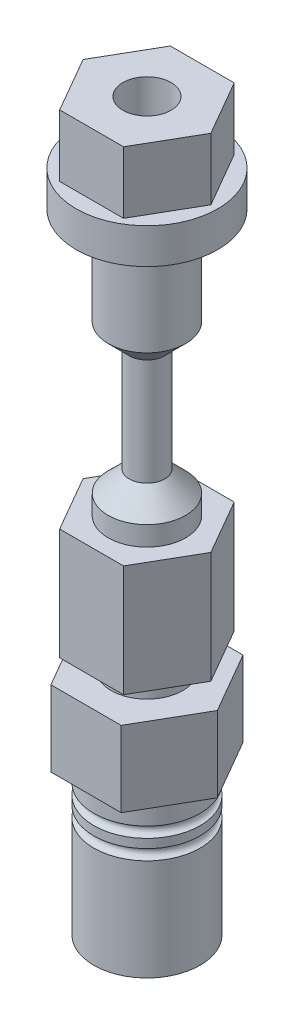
SolidWorks part; units mm, degrees
ref_plane "Front Plane" through (0, 0, 0) normal (0, 0, 1) x (1, 0, 0)
ref_plane "Top Plane" through (0, 0, 0) normal (0, 1, 0) x (1, 0, 0)
ref_plane "Right Plane" through (0, 0, 0) normal (1, 0, 0) x (0, 0, -1)
sketch "Sketch2" plane through (0, 0, 0) normal (0, 1, 0) x (1, 0, 0)
  line L1 (4.5827, 7.9375) -> (-4.5827, 7.9375)
  line L2 (-4.5827, 7.9375) -> (-9.1654, 0)
  line L3 (-9.1654, 0) -> (-4.5827, -7.9375)
  line L4 (-4.5827, -7.9375) -> (4.5827, -7.9375)
  line L5 (4.5827, -7.9375) -> (9.1654, 0)
  line L6 (9.1654, 0) -> (4.5827, 7.9375)
  circle A1 centre (0, 0) radius 7.9375 construction
  dimension "D1" = 15.875
extrude "Boss-Extrude1" add sketch "Sketch2" along normal blind 8.89
sketch "Sketch3" plane through (0, 0, 0) normal (0, 0, 1) x (1, 0, 0)
  line L0 (0, 0) -> (0, -52.7983) construction
  line L1 (-2.54, -22.0662) -> (-2.54, -37.3698)
  line L3 (-2.54, -37.3698) -> (-5.5562, -40.386)
  line L5 (0, -53.086) -> (0, 0)
  line L7 (-5.5562, -40.386) -> (-5.5562, -53.086)
  line L8 (-5.5562, -53.086) -> (0, -53.086)
  line L9 (0, 0) -> (-10.16, 0)
  line L11 (-10.16, 0) -> (-10.16, -5.08)
  line L12 (-10.16, -5.08) -> (-4.6266, -5.08)
  line L13 (-4.6266, -5.08) -> (-4.6266, -7.1628)
  line L16 (-4.6266, -7.1628) -> (-5.5562, -7.1628)
  line L17 (-5.5562, -7.1628) -> (-5.5562, -19.05)
  line L18 (-5.5562, -19.05) -> (-2.54, -22.0662)
  line L19 (-4.5827, 8.89) -> (4.5827, 8.89) construction
  dimension "D1" = 5.08
  dimension "D2" = 135
  dimension "D3" = 11.1125
  dimension "D4" = 61.976
  dimension "D5" = 12.7
  dimension "D7" = 20.32
  dimension "D8" = 5.08
  dimension "D9" = 9.2532
  dimension "D10" = 2.0828
  dimension "D11" = 11.1125
  dimension "D12" = 11.8872
  dimension "D13" = 45
revolve "Revolve1" add sketch "Sketch3" angle 360 about L0
ref_plane "Plane1" through (0, -43.18, 0) normal (0, 1, 0) x (1, 0, 0)
sketch "Sketch5" plane through (0, -43.18, 0) normal (0, -1, 0) x (1, 0, 0)
  line L1 (4.5827, 7.9375) -> (-4.5827, 7.9375)
  line L2 (-4.5827, 7.9375) -> (-9.1654, 0)
  line L3 (-9.1654, 0) -> (-4.5827, -7.9375)
  line L4 (-4.5827, -7.9375) -> (4.5827, -7.9375)
  line L5 (4.5827, -7.9375) -> (9.1654, 0)
  line L6 (9.1654, 0) -> (4.5827, 7.9375)
  circle A0 centre (0, 0) radius 7.9375 construction
  dimension "D1" = 15.875
extrude "Boss-Extrude3" add sketch "Sketch5" along normal blind 16.002
sketch "Sketch7" plane through (0, 0, 0) normal (0, 0, 1) x (1, 0, 0)
  line L0 (0, -59.182) -> (0, -64.0951) construction
  line L1 (4.5827, -59.182) -> (-4.5827, -59.182) construction
  line L2 (-4.8095, -51.6301) -> (-5.1435, -62.357)
  line L3 (-5.1435, -62.357) -> (0, -62.357)
  line L4 (0, -62.357) -> (0, -51.6301)
  line L5 (0, -51.6301) -> (-4.8095, -51.6301)
  dimension "D1" = 1.783
  dimension "D2" = 10.287
  dimension "D3" = 3.175
revolve "Revolve2" add sketch "Sketch7" angle 360 about L0
sketch "Sketch8" plane through (0, -62.357, 0) normal (0, -1, 0) x (1, 0, 0)
  line L1 (5.0447, 8.7376) -> (-5.0447, 8.7376)
  line L2 (-5.0447, 8.7376) -> (-10.0893, 0)
  line L3 (-10.0893, 0) -> (-5.0447, -8.7376)
  line L4 (-5.0447, -8.7376) -> (5.0447, -8.7376)
  line L5 (5.0447, -8.7376) -> (10.0893, 0)
  line L6 (10.0893, 0) -> (5.0447, 8.7376)
  circle A0 centre (0, 0) radius 8.7376 construction
  dimension "D1" = 17.4752
extrude "Boss-Extrude4" add sketch "Sketch8" along normal blind 10.8458
sketch "Sketch9" plane through (0, 0, 0) normal (0, 0, 1) x (1, 0, 0)
  line L0 (0, -73.2028) -> (0, -99.3798) construction
  line L1 (5.0447, -73.2028) -> (-5.0447, -73.2028) construction
  line L2 (0, -73.2028) -> (-7.62, -73.2028)
  line L3 (-7.62, -73.2028) -> (-7.62, -76.3778)
  line L4 (-7.62, -77.9018) -> (-7.62, -79.1718)
  line L5 (-7.62, -80.6958) -> (-7.62, -95.25)
  line L6 (-7.62, -95.25) -> (0, -95.25)
  line L7 (0, -95.25) -> (0, -73.2028)
  line L8 (-4.5827, -59.182) -> (-9.1654, -59.182) construction
  arc A0 (-7.62, -77.9018) -> (-7.62, -76.3778) centre (-7.62, -77.1398) ccw
  arc A1 (-7.62, -80.6958) -> (-7.62, -79.1718) centre (-7.62, -79.9338) ccw
  dimension "D3" = 0.762
  dimension "D4" = 0.762
  dimension "D1" = 3.175
  dimension "D2" = 1.27
  dimension "D5" = 15.24
  dimension "D6" = 36.068
revolve "Revolve3" add sketch "Sketch9" angle 360 about L0
hole_wizard "5/16-24 Tapped Hole1" positions "Sketch11" profile "Sketch10" tap size "5/16-24" standard "ANSI Inch"
sketch "Sketch11" plane through (0, 8.89, 0) normal (0, 1, 0) x (1, 0, 0)
  point P0 (0, 0)
sketch "Sketch10" plane through (0, 8.89, 0) normal (1, 0, 0) x (0, 0, 1)
  line L0 (0, 0) -> (0, 14.7756)
  line L1 (0, 14.7756) -> (3.4544, 12.7)
  line L2 (3.4544, 12.7) -> (3.4544, 0)
  line L5 (3.4544, 0) -> (0, 0)
  line L10 (0, 14.7756) -> (-3.4544, 12.7) construction
  line L11 (0, -6.35) -> (0, 107.95) construction
  dimension "Tap Drill Dia." = 6.9088
  dimension "Tap Drill Depth" = 12.7
  dimension "Drill Angle" = 118
sketch "Sketch12" plane through (0, 0, 0) normal (0, 0, 1) x (1, 0, 0)
  line L0 (0, 15.3586) -> (0, -104.3207) construction
  line L1 (0, 12.2256) -> (-3.4544, 12.2256)
  line L2 (-3.4544, 12.2256) -> (-3.4544, -3.81)
  line L3 (-3.4544, -3.81) -> (-2.5527, -3.81)
  line L4 (-2.5527, -3.81) -> (-2.5527, -16.51)
  line L5 (-2.5527, -16.51) -> (-1.5875, -16.51)
  line L6 (-1.5875, -16.51) -> (-1.5875, -36.83)
  line L7 (-1.5875, -36.83) -> (-1.27, -36.83)
  line L8 (-1.27, -36.83) -> (-1.27, -53.086)
  line L9 (-1.27, -53.086) -> (0, -53.086)
  line L10 (0, -53.086) -> (0, 12.2256)
  line L11 (-4.5827, 8.89) -> (-9.1654, 8.89) construction
  line L12 (-9.1654, 8.89) -> (-4.5827, 8.89) construction
  dimension "D1" = 2.54
  dimension "D2" = 3.175
  dimension "D3" = 5.1054
  dimension "D4" = 6.9088
  dimension "D5" = 12.7
  dimension "D6" = 25.4
  dimension "D7" = 45.72
  dimension "D8" = 61.976
revolve "Cut-Revolve1" cut sketch "Sketch12" angle 360 about L0
